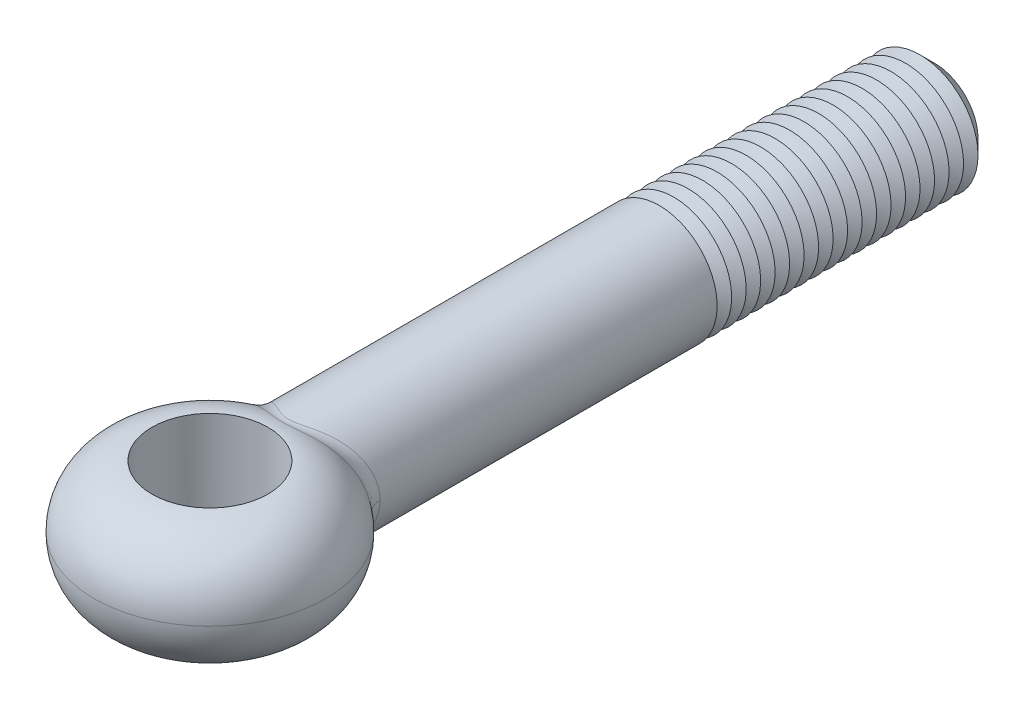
SolidWorks part; units mm, degrees
ref_plane "Front Plane" through (0, 0, 0) normal (0, 0, 1) x (1, 0, 0)
ref_plane "Top Plane" through (0, 0, 0) normal (0, 1, 0) x (1, 0, 0)
ref_plane "Right Plane" through (0, 0, 0) normal (1, 0, 0) x (0, 0, -1)
sketch "Sketch7" plane through (0, 0, 0) normal (0, 1, 0) x (1, 0, 0)
  circle A0 centre (0, 0) radius 16
  dimension "D1" = 32
extrude "Boss-Extrude3" add sketch "Sketch7" along normal mid plane 17
sketch "Sketch8" plane through (0, 0, 0) normal (0, 0, 1) x (1, 0, 0)
  circle A0 centre (0, 0) radius 8
  dimension "D1" = 16
extrude "Boss-Extrude4" add sketch "Sketch8" against normal blind 100
fillet "Fillet5" radius 8.5 2 edges at (0, -8.5, 16) (0, 8.5, 16)
fillet "Fillet6" radius 3 2 edges at (-0.1803, -7.998, -10.3764) (0.1803, 7.998, -10.3764)
chamfer "Chamfer1" distance 2 angle 45 1 edges at (8, 0, -100)
sketch "Sketch10" plane through (0, 0, 0) normal (0, 1, 0) x (1, 0, 0)
  line L0 (0, 28.1405) -> (0, -7.9233) construction
sketch "Sketch11" plane through (0, 0, 0) normal (0, 1, 0) x (1, 0, 0)
  line L0 (-8, 62) -> (-6.2679, 63)
  line L1 (-8, 98) -> (-8, 15.4919) construction
  line L2 (-6.2679, 63) -> (-8, 64)
  line L3 (-8, 64) -> (-8, 62)
  line L4 (6, 100) -> (-6, 100) construction
  dimension "D1" = 2
  dimension "D2" = 38
revolve "Cut-Revolve1" cut sketch "Sketch11" angle 360 about L0
pattern_linear "LPattern1" count 18 spacing 2 along (0, 0, -1) of "Cut-Revolve1"
sketch "Sketch12" plane through (0, 0, 0) normal (0, 1, 0) x (1, 0, 0)
  circle A0 centre (0, 0) radius 8
  dimension "D1" = 16
extrude "Cut-Extrude1" cut sketch "Sketch12" against normal mid plane 17
